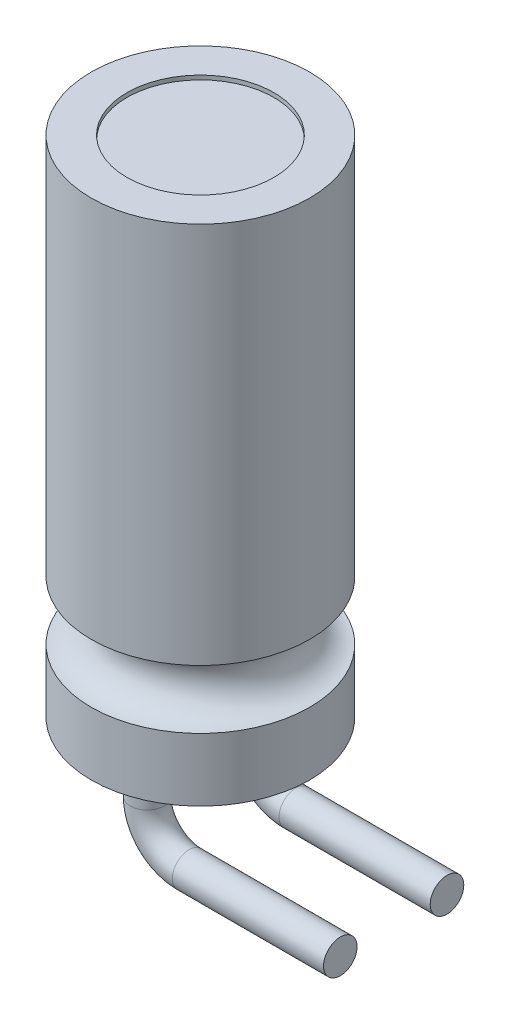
SolidWorks part; units mm, degrees
ref_plane "Face" through (0, 0, 0) normal (0, 0, 1) x (1, 0, 0)
ref_plane "Dessus" through (0, 0, 0) normal (0, 1, 0) x (1, 0, 0)
ref_plane "Droite" through (0, 0, 0) normal (1, 0, 0) x (0, 0, -1)
sketch "Esquisse1" plane through (0, 0, 0) normal (0, 0, 1) x (1, 0, 0)
  line L0 (0, 48.4017) -> (0, -33.7592) construction
  line L1 (0, 39.5164) -> (2.6, 39.5164)
  line L2 (2.6, 39.5164) -> (2.6, 30.4164)
  line L3 (2.6, 29.0164) -> (2.6, 27.5164)
  line L4 (2.6, 27.5164) -> (0, 27.5164)
  line L5 (0, 27.5164) -> (0, 39.5164)
  line L6 (9.8114, 29.7164) -> (-7.1309, 29.7164) construction
  line L7 (2.6, 25.0819) -> (2.6, 32.6721) construction
  line L8 (5.1241, 27.5164) -> (-5.6865, 27.5164) construction
  line L9 (5.1241, 29.0164) -> (-3.1767, 29.0164) construction
  arc A0 (2.6, 30.4164) -> (2.6, 29.0164) centre (2.6, 29.7164) ccw
  dimension "D4" = 0.7
  dimension "D1" = 12
  dimension "D2" = 2.6
  dimension "D3" = 1.5
revolve "Révolution1" add sketch "Esquisse1" angle 360 about L0
sketch "Esquisse2" plane through (0, 39.5164, 0) normal (0, 1, 0) x (-1, 0, 0)
  circle A0 centre (0, 0) radius 1.75
  dimension "D1" = 3.5
extrude "Enlèv. mat.-Extru.1" cut sketch "Esquisse2" against normal blind 0.1
sketch "Esquisse3" plane through (0, 27.5164, 0) normal (0, -1, 0) x (1, 0, 0)
  line L0 (4.0351, 0) -> (-4.283, 0) construction
  line L1 (0, 6.7464) -> (0, -6.9013) construction
  line L2 (4.0351, 1.27) -> (-0.9275, 1.27) construction
  circle A0 centre (0, 1.27) radius 0.4
  dimension "D2" = 1.27
ref_plane "Plan1" through (0, 0, 1.27) normal (0, 0, 1) x (1, 0, 0)
sketch "Esquisse6" plane through (0, 0, 1.27) normal (0, 0, 1) x (1, 0, 0)
  line L0 (0, 27.5164) -> (0, 26.5164)
  line L1 (4.0351, 27.5164) -> (-0.9275, 27.5164) construction
  line L2 (4.6, 25.5164) -> (1, 25.5164)
  line L3 (8.1449, 27.5164) -> (-3.7913, 27.5164) construction
  line L4 (4.0351, 27.5164) -> (-4.283, 27.5164) construction
  line L5 (2.6, 29.6776) -> (2.6, 22.9441) construction
  line L6 (4.6, 29.6776) -> (4.6, 22.9441) construction
  arc A0 (0, 26.5164) -> (1, 25.5164) centre (1, 26.5164) ccw
  dimension "D3" = 1
  dimension "D1" = 2
  dimension "D2" = 2
sweep "Balayage1" add profiles "Esquisse3" path "Esquisse6"
ref_plane "Plan2" through (0, 0, 0) normal (0, 0, 1) x (1, 0, 0)
mirror "Symétrie1" about plane through (0, 0, 0) normal (0, 0, 1) of "Balayage1"
